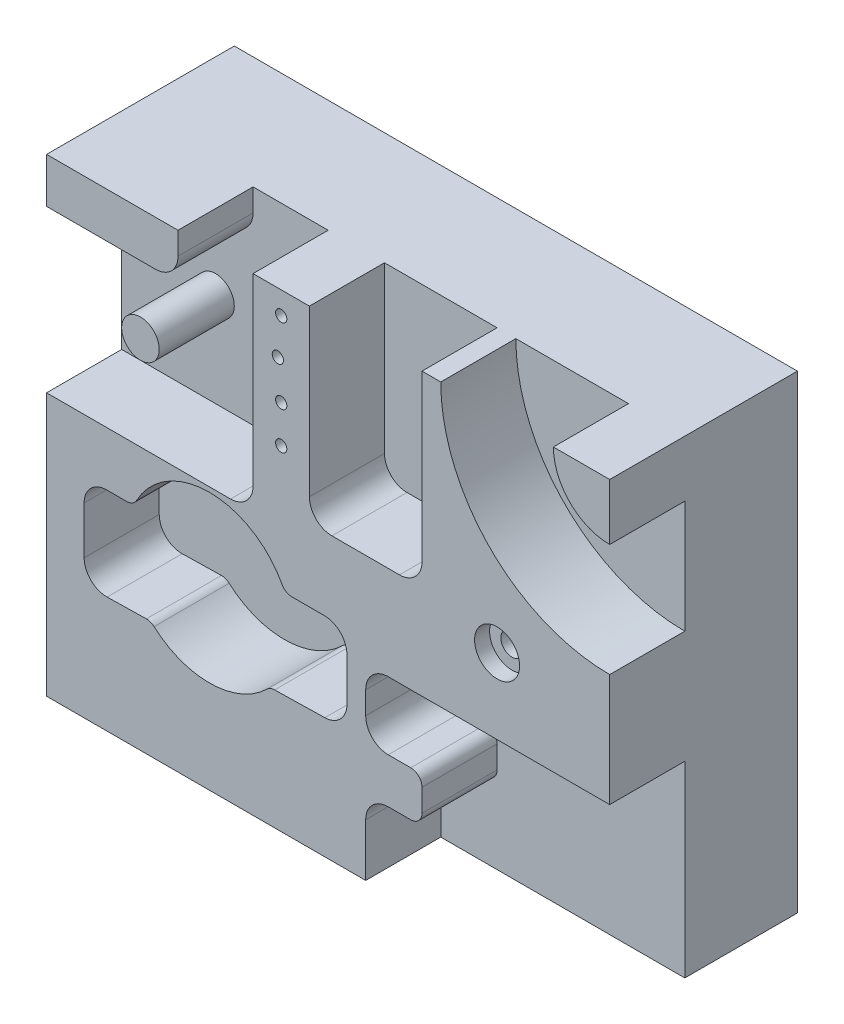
SolidWorks part; units mm, degrees
ref_plane "Front Plane" through (0, 0, 0) normal (0, 0, 1) x (1, 0, 0)
ref_plane "Top Plane" through (0, 0, 0) normal (0, 1, 0) x (1, 0, 0)
ref_plane "Right Plane" through (0, 0, 0) normal (1, 0, 0) x (0, 0, -1)
sketch "Sketch1" plane through (0, 0, 0) normal (0, 0, 1) x (1, 0, 0)
  line L0 (-75, -62.5) -> (75, -62.5)
  line L1 (75, -62.5) -> (75, 62.5)
  line L2 (75, 62.5) -> (-75, 62.5)
  line L3 (-75, 62.5) -> (-75, -62.5)
  line L4 (-75, 62.5) -> (75, -62.5) construction
  dimension "D1" = 125
  dimension "D2" = 150
extrude "Boss-Extrude1" add sketch "Sketch1" against normal blind 50
sketch "Sketch2" plane through (75, 0, 0) normal (1, 0, 0) x (0, 0, -1)
  line L0 (20, -62.5) -> (20, -12.5)
  line L1 (20, -12.5) -> (0, -12.5)
  line L2 (0, -12.5) -> (0, -62.5)
  line L3 (0, -62.5) -> (20, -62.5)
  dimension "D1" = 20
  dimension "D2" = 50
extrude "Cut-Extrude1" cut sketch "Sketch2" against normal blind 65
sketch "Sketch3" plane through (0, 0, -20) normal (0, 0, 1) x (1, 0, 0)
  line L0 (10, -30.5) -> (25, -30.5)
  line L1 (25, -30.5) -> (25, -42.5)
  line L2 (25, -42.5) -> (10, -42.5)
  line L3 (10, -42.5) -> (10, -30.5)
  line L4 (10, -62.5) -> (75, -62.5) construction
  line L5 (10, -62.5) -> (10, -12.5) construction
  dimension "D1" = 20
  dimension "D2" = 12
  dimension "D3" = 15
extrude "Boss-Extrude2" add sketch "Sketch3" along normal up to surface (20 mm away)
sketch "Sketch4" plane through (0, 0, 0) normal (0, 0, 1) x (1, 0, 0)
  line L0 (-75, 7.5) -> (-20, 7.5)
  line L1 (-20, 7.5) -> (-20, 62.5)
  line L2 (-20, 62.5) -> (-75, 62.5)
  line L3 (-75, 62.5) -> (-75, 7.5)
  dimension "D1" = 55
  dimension "D2" = 55
extrude "Cut-Extrude2" cut sketch "Sketch4" against normal up to surface (20 mm away)
sketch "Sketch5" plane through (0, 0, -20) normal (0, 0, 1) x (1, 0, 0)
  line L0 (-75, 62.5) -> (-75, 7.5) construction
  line L1 (-20, 62.5) -> (-75, 62.5) construction
  circle A0 centre (-50, 32.5) radius 5
  dimension "D1" = 10
  dimension "D2" = 25
  dimension "D3" = 30
extrude "Boss-Extrude3" add sketch "Sketch5" along normal up to surface (20 mm away)
sketch "Sketch6" plane through (0, 0, -20) normal (0, 0, 1) x (1, 0, 0)
  line L0 (-75, 50.5) -> (-75, 62.5)
  line L1 (-75, 62.5) -> (-40, 62.5)
  line L2 (-40, 62.5) -> (-40, 50.5)
  line L3 (-40, 50.5) -> (-75, 50.5)
  dimension "D1" = 12
  dimension "D2" = 35
extrude "Boss-Extrude4" add sketch "Sketch6" along normal up to surface (20 mm away)
sketch "Sketch7" plane through (0, 0, 0) normal (0, 0, 1) x (1, 0, 0)
  line L0 (75, 62.5) -> (30, 62.5)
  line L1 (75, 17.5) -> (75, 62.5)
  arc A0 (30, 62.5) -> (75, 17.5) centre (75, 62.5) ccw
  dimension "D1" = 45
extrude "Cut-Extrude3" cut sketch "Sketch7" against normal up to surface (20 mm away)
sketch "Sketch8" plane through (0, 0, -20) normal (0, 0, 1) x (1, 0, 0)
  line L0 (60, 62.5) -> (75, 62.5)
  line L1 (75, 62.5) -> (75, 47.5)
  arc A0 (75, 47.5) -> (60, 62.5) centre (75, 62.5) cw
  dimension "D1" = 15
extrude "Boss-Extrude5" add sketch "Sketch8" along normal up to surface (20 mm away)
sketch "Sketch9" plane through (0, 62.5, 0) normal (0, 1, 0) x (-1, 0, 0)
  line L0 (5, -20) -> (5, 0)
  line L1 (5, 0) -> (-25, 0)
  line L2 (-25, 0) -> (-25, -20)
  line L3 (-25, -20) -> (5, -20)
  line L4 (-75, -50) -> (-75, 0) construction
  line L5 (-30, 0) -> (20, 0) construction
  line L6 (-10, -20) -> (-75, -20) construction
  dimension "D1" = 30
  dimension "D2" = 50
extrude "Cut-Extrude4" cut sketch "Sketch9" against normal blind 50
sketch "Sketch10" plane through (0, 0, 0) normal (0, 0, 1) x (1, 0, 0)
  line L0 (-15.4938, -30.6908) -> (5, -30.2784)
  line L1 (5, -30.2784) -> (5, -6.9026)
  line L2 (5, -6.9026) -> (-11.5081, -6.9026)
  line L3 (-51.7878, -6.9026) -> (-65, -6.9026)
  line L4 (-65, -6.9026) -> (-65, -31.6872)
  line L5 (-65, -31.6872) -> (-47.1881, -31.3287)
  line L6 (-75, 7.5) -> (-75, -62.5) construction
  arc A0 (-11.5081, -6.9026) -> (-51.7878, -6.9026) centre (-31.6479, -15.7562) ccw
  arc A1 (-47.1881, -31.3287) -> (-15.4938, -30.6908) centre (-31.6479, -15.7562) ccw
  dimension "D3" = 22
  dimension "D4" = 22
  dimension "D1" = 10
  dimension "D2" = 70
extrude "Cut-Extrude5" cut sketch "Sketch10" against normal up to surface (20 mm away)
fillet "Fillet1" radius 3 6 edges at (-47.1881, -31.3287, -10) (25, -42.5, -10) (25, -30.5, -10) (-15.4938, -30.6908, -10) (-11.5081, -6.9026, -10) (-51.7878, -6.9026, -10)
fillet "Fillet7" radius 6 1 edges at (-40, 50.5, -10)
fillet "Fillet8" radius 6 10 edges at (10, -12.5, -10) (5, -6.9026, -10) (10, -30.5, -10) (-5, 12.5, -10) (25, 12.5, -10) (-20, 7.5, -10) (5, -30.2784, -10) (-65, -31.6872, -10) (-65, -6.9026, -10) (10, -42.5, -10)
hole_wizard "CBORE for M5 Hex Head Bolt1" positions "Sketch12" profile "Sketch11" counterbore size "M5" standard "Ansi Metric"
sketch "Sketch12" plane through (0, 0, 0) normal (0, 0, 1) x (1, 0, 0)
  line L0 (16, -12.5) -> (75, -12.5) construction
  line L1 (75, -12.5) -> (75, 17.5) construction
  point P0 (45, 7.5)
  dimension "D1" = 20
  dimension "D2" = 30
sketch "Sketch11" plane through (45, 7.5, 0) normal (1, 0, 0) x (0, -1, 0)
  line L0 (0, 0) -> (0, 20.8026)
  line L1 (0, 20.8026) -> (3, 19)
  line L2 (3, 19) -> (3, 4)
  line L3 (3, 4) -> (6, 4)
  line L4 (6, 4) -> (6, 0)
  line L5 (6, 0) -> (0, 0)
  line L10 (0, 20.8026) -> (-3, 19) construction
  line L11 (0, -6.35) -> (0, 107.95) construction
  dimension "Hole Dia." = 6
  dimension "Hole Depth" = 19
  dimension "C'Bore Dia." = 12
  dimension "C'Bore Depth" = 4
  dimension "Drill Angle" = 118
hole_wizard "Ø3.0 (3) Diameter Hole1" positions "Sketch14" profile "Sketch13" hole size "Ø3.0" standard "Ansi Metric"
sketch "Sketch14" plane through (0, 0, 0) normal (0, 0, 1) x (1, 0, 0)
  line L0 (-12.5, 62.5) -> (-12.5, 12.5) construction
  line L1 (-5, 62.5) -> (-20, 62.5) construction
  point P0 (-13.4018, 46.5)
  point P6 (-12.5, 56.5)
  point P8 (-12.5, 36.5)
  point P10 (-12.5, 26.5)
  dimension "D1" = 50
  dimension "D2" = 6
  dimension "D3" = 10
  dimension "D4" = 10
  dimension "D5" = 10
sketch "Sketch13" plane through (-13.4018, 46.5, 0) normal (1, 0, 0) x (0, -1, 0)
  line L0 (0, 0) -> (0, 12.9013)
  line L1 (0, 12.9013) -> (1.5, 12)
  line L2 (1.5, 12) -> (1.5, 0)
  line L5 (1.5, 0) -> (0, 0)
  line L10 (0, 12.9013) -> (-1.5, 12) construction
  line L11 (0, -6.35) -> (0, 107.95) construction
  dimension "Hole Dia." = 3
  dimension "Hole Depth" = 12
  dimension "Drill Angle" = 118
